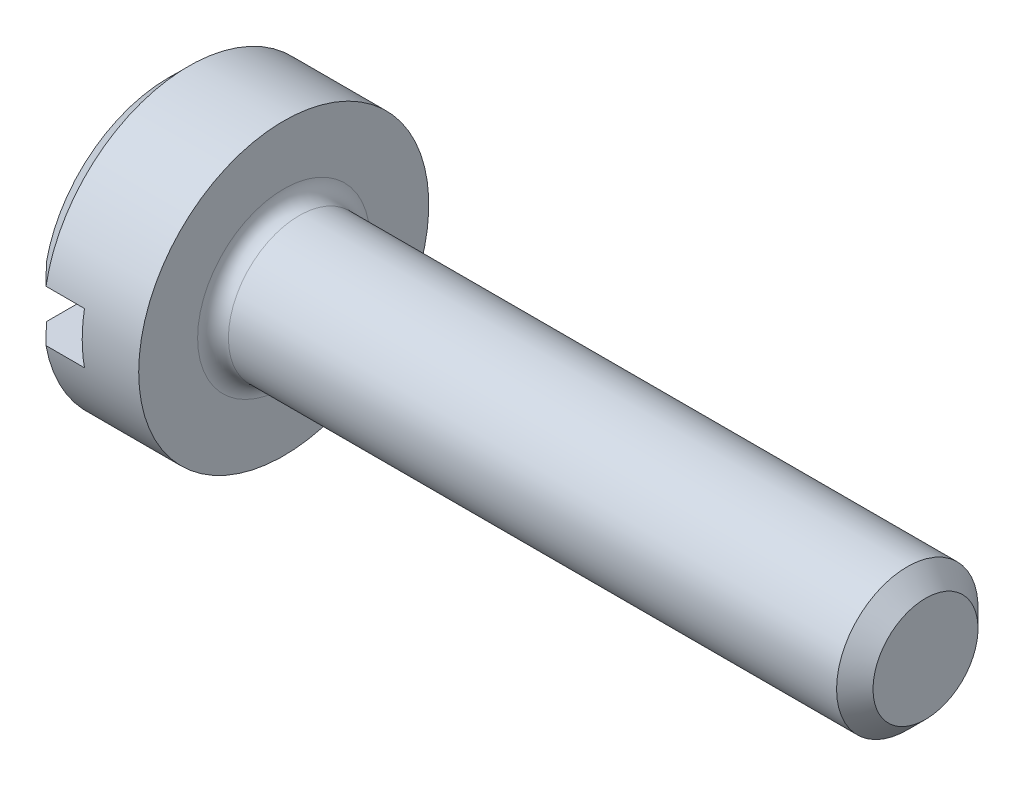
SolidWorks part; units mm, degrees
ref_plane "Plane1" through (0, 0, 0) normal (0, 0, 1) x (1, 0, 0)
ref_plane "Plane2" through (0, 0, 0) normal (0, 1, 0) x (1, 0, 0)
ref_plane "Plane3" through (0, 0, 0) normal (1, 0, 0) x (0, 0, -1)
sketch "BodySke" plane through (0, 0, 0) normal (0, 0, 1) x (1, 0, 0)
  line L0 (1.143, 0.6998) -> (1.143, 1.4351)
  line L1 (0, 0) -> (0, 1.2319)
  line L2 (-25.4, 0) -> (127, 0) construction
  line L3 (7.493, 0) -> (0, 0)
  line L4 (1.143, 0.6998) -> (7.3127, 0.6998)
  line L5 (7.493, 0.5194) -> (7.493, 0)
  line L6 (0.2032, 1.4351) -> (1.143, 1.4351)
  line L7 (0.2032, 1.4351) -> (0, 1.2319)
  line L8 (7.3127, 0.6998) -> (7.493, 0.5194)
  line L9 (1.397, 0) -> (1.397, 1.4351) construction
  line L10 (5.2041, 1.4351) -> (5.2041, -0.2757) construction
  dimension "Head_ht" = 1.143
  dimension "Diameter" = 1.3995
  dimension "Length" = 6.35
  dimension "Head_dia" = 2.8702
  dimension "Minor_dia" = 1.0389
  dimension "D6" = 45
  dimension "D7" = 45
  dimension "Head_chf_len" = 0.2032
  dimension "Advance" = 0.254
  dimension "Thread_nom" = 2.2889
revolve "Base-Revolve" add sketch "BodySke"
fillet "Fillet1" radius 0.1524 1 edges at (1.143, 0, 0.6998)
ref_plane "Plane4" through (0.5842, 0, 0) normal (1, 0, 0) x (0, 0, -1)
sketch "Sketch2" plane through (0.5842, 0, 0) normal (1, 0, 0) x (0, 0, -1)
  line L0 (1.4351, -0.254) -> (-1.4351, -0.254)
  line L1 (1.4351, -0.254) -> (1.4351, 0.254)
  line L2 (-1.4351, 0.254) -> (1.4351, 0.254)
  line L3 (-1.4351, 0.254) -> (-1.4351, -0.254)
  dimension "D1" = 2.8702
  dimension "D2" = 1.4351
  dimension "Slot_width" = 0.508
  dimension "D3" = 0.254
extrude "Slot" cut sketch "Sketch2" against normal through all
sketch "ThdSchSke" plane through (0, 0, 0) normal (0, 0, 1) x (1, 0, 0)
  line L0 (5.2041, -0.5194) -> (5.0778, -0.6998)
  line L1 (5.2041, -0.5194) -> (5.3303, -0.6998)
  line L2 (5.3303, -0.6998) -> (5.3303, -0.8747)
  line L3 (-3.175, 0) -> (5.1513, 0) construction
  line L4 (0, -0.254) -> (0, -1.2319) construction
  line L5 (5.3303, -0.8747) -> (5.0778, -0.8747)
  line L6 (5.0778, -0.8747) -> (5.0778, -0.6998)
  dimension "Thread_minor" = 1.0389
  dimension "Diameter" = 1.3995
  dimension "Start" = 5.2041
  dimension "SideAngle" = 55
  dimension "VeeAngle" = 70
  dimension "Overcut" = 1.7494
revolve "ThreadSchematic" [suppressed] cut sketch "ThdSchSke" angle 360 about L3
pattern_linear "ThdSchPat" [suppressed]
equation "\"D1@Sketch2\" = \"Head_dia@BodySke\""
equation "\"D2@Sketch2\" = \"D1@Sketch2\" / 2"
equation "\"D3@Sketch2\" = \"Slot_width@Sketch2\" / 2"
equation "\"Thread_minor@ThreadCosmetic\" = \"Minor_dia@BodySke\""
equation "\"Thread_length@ThreadCosmetic\" = ((sgn( (\"Length@BodySke\" - \"Advance@BodySke\" ) - \"Thread_nom@BodySke\" )-1)*( (\"Length@BodySke\" - \"Advance@BodySke\" ) - \"Thread_nom@BodySke\" ))/-2+ \"Thread_nom@BodySke\""
equation "\"Thread_minor@ThdSchSke\" = \"Minor_dia@BodySke\""
equation "\"Diameter@ThdSchSke\" = \"Diameter@BodySke\""
equation "\"Overcut@ThdSchSke\" = \"Diameter@BodySke\" * 1.25"
equation "\"Start@ThdSchSke\" = \"Head_ht@BodySke\" + \"Length@BodySke\" - \"Thread_length@ThreadCosmetic\"  '---Non-countersunk---"
equation "\"Num_threads@ThdSchPat\" = int( \"Thread_length@ThreadCosmetic\" / \"Advance@BodySke\" + 0.999 )  + 1"
equation "\"Advance@ThdSchPat\" = \"Thread_length@ThreadCosmetic\" /  (\"Num_threads@ThdSchPat\" - 1) 'relax it"
equation "\"Num_threads@ThdSchPat\" = \"Num_threads@ThdSchPat\" - sgn( \"Num_threads@ThdSchPat\" - 1) '---chamfered tips only---"
